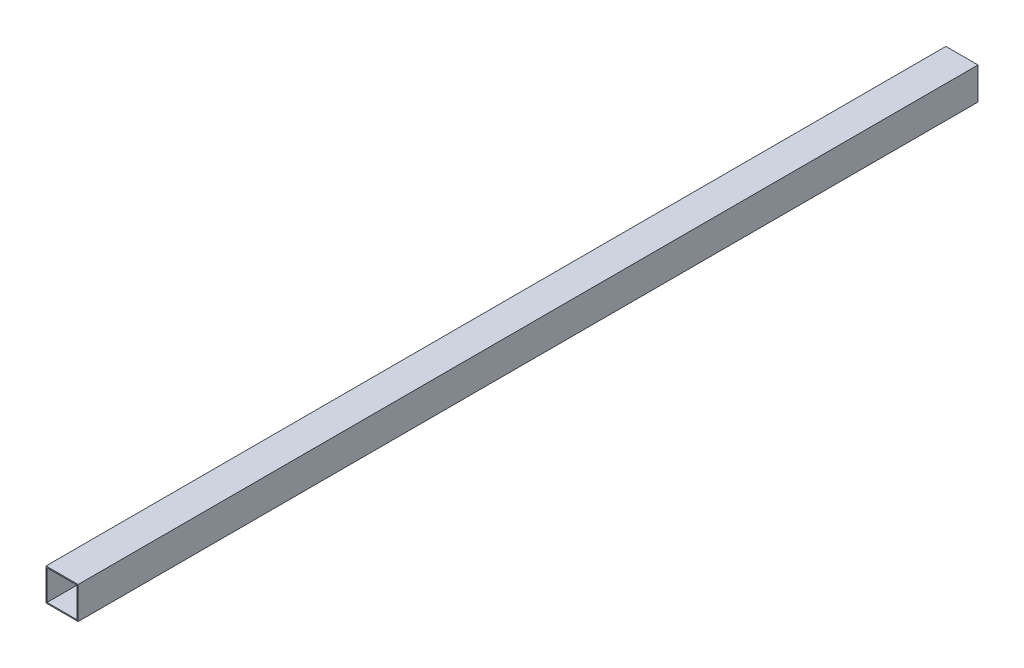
SolidWorks part; units mm, degrees
ref_plane "Piano frontale" through (0, 0, 0) normal (0, 0, 1) x (1, 0, 0)
ref_plane "Piano superiore" through (0, 0, 0) normal (0, 1, 0) x (1, 0, 0)
ref_plane "Piano destro" through (0, 0, 0) normal (1, 0, 0) x (0, 0, -1)
sketch "Schizzo1" plane through (0, 0, 0) normal (0, 0, 1) x (1, 0, 0)
  line L1 (-15, -15) -> (15, -15)
  line L2 (-15, -15) -> (-15, 15)
  line L3 (-15, 15) -> (15, 15)
  line L4 (15, -15) -> (15, 15)
  line L5 (-15, -15) -> (15, 15) construction
  line L6 (-15, 15) -> (15, -15) construction
  point P0 (0, 0)
  dimension "D1" = 30
  dimension "D2" = 30
extrude "Estrusione-Sottile1" add sketch "Schizzo1" along normal blind 840 thin
